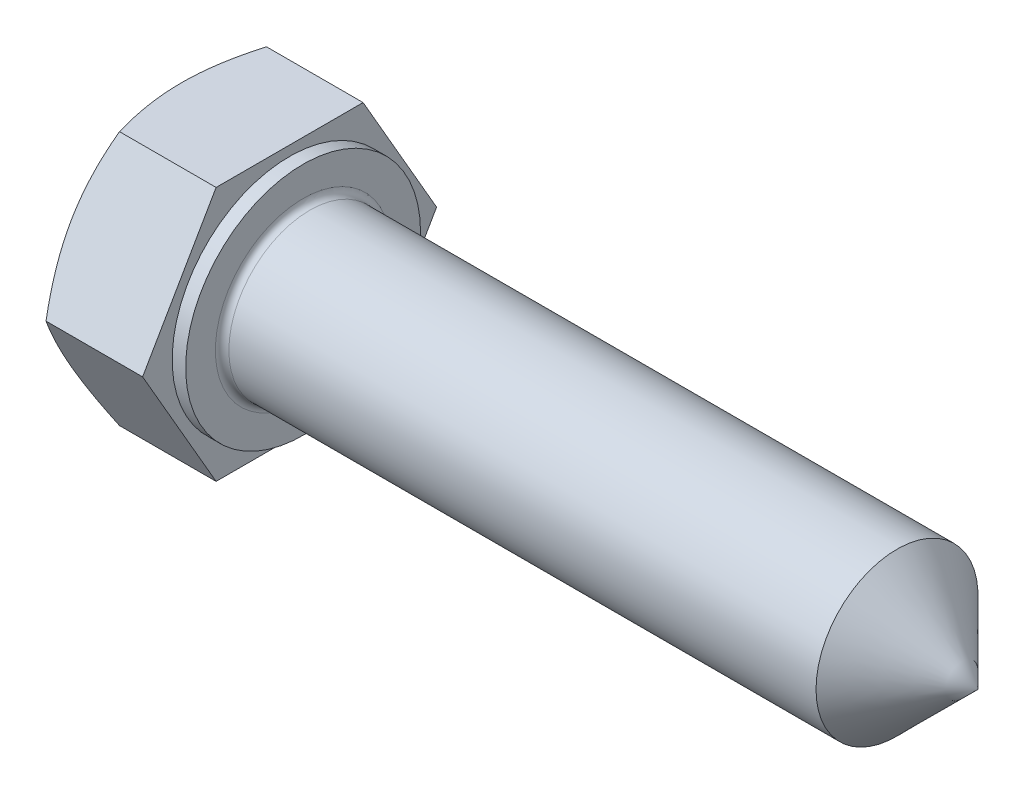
SolidWorks part; units mm, degrees
ref_plane "Front" through (0, 0, 0) normal (0, 0, 1) x (1, 0, 0)
ref_plane "Top" through (0, 0, 0) normal (0, 1, 0) x (1, 0, 0)
ref_plane "Right" through (0, 0, 0) normal (1, 0, 0) x (0, 0, -1)
sketch "Sketch3" plane through (0, 0, 0) normal (1, 0, 0) x (0, 0, -1)
  line L1 (-5.445, 0) -> (-2.7225, -4.7155)
  line L2 (-2.7225, -4.7155) -> (2.7225, -4.7155)
  line L3 (2.7225, -4.7155) -> (5.445, 0)
  line L4 (5.445, 0) -> (2.7225, 4.7155)
  line L5 (2.7225, 4.7155) -> (-2.7225, 4.7155)
  line L6 (-2.7225, 4.7155) -> (-5.445, 0)
  circle A0 centre (0, 0) radius 4.7155 construction
  dimension "e" = 10.89
extrude "BaseHead" add sketch "Sketch3" along normal blind 4
sketch "Sketch2" plane through (4, -1.7393, 0.8693) normal (1, 0, 0) x (0, 0, -1)
  circle A0 centre (0.8693, 1.7393) radius 4.35
  dimension "dw" = 8.7
extrude "Neck" add sketch "Sketch2" along normal blind 0.5
sketch "Sketch1" plane through (4.5, -1.8832, 0.2627) normal (1, 0, 0) x (0, 0, -1)
  circle A0 centre (0.2627, 1.8832) radius 3
  dimension "d" = 6
extrude "BaseBody" add sketch "Sketch1" along normal blind 25
sketch "Sketch4" plane through (6.9064, 0, -1.4614) normal (0, 1, 0) x (0, 0, -1)
  line L0 (3.9836, 2.9064) -> (3.9836, 6.9064) construction
  line L1 (3.9836, 6.9064) -> (3.9836, 6.4852)
  line L3 (3.2541, 6.9064) -> (3.9836, 6.9064)
  line L4 (-1.4614, -0.8876) -> (-1.4614, 9.2553) construction
  line L6 (3.2541, 6.9064) -> (3.9836, 6.4852)
  line L7 (3.9836, 6.9064) -> (1.2611, 6.9064) construction
  dimension "D2" = 30
revolve "Cut-Revolve1" cut sketch "Sketch4" angle 360 about L4
sketch "Sketch6" plane through (-10.5798, 0, 31.5798) normal (0, 1, 0) x (0, 0, -1)
  line L0 (31.5798, -1.5701) -> (31.5798, -40.5895) construction
  line L2 (31.5798, -43.0146) -> (52.5798, -43.0146)
  line L3 (52.5798, -43.0146) -> (52.5798, -19.0798)
  line L4 (52.5798, -19.0798) -> (31.5798, -40.0798)
  line L5 (31.5798, -40.0798) -> (31.5798, -43.0146)
  line L6 (28.5798, -40.0798) -> (34.5798, -40.0798) construction
  dimension "D1" = 45
  dimension "D2" = 21
  dimension "D3" = 2.9348
revolve "Cut-Revolve2" cut sketch "Sketch6" angle 360 about L0
fillet "Fillet1" radius 0.25 1 edges at (4.5, 0, -3)
sketch "Sketch7" plane through (0, 0, 0) normal (0, 0, 1) x (1, 0, 0)
  line L0 (6.5, 3.2) -> (7.25, 3.2)
  line L1 (7.25, 3.2) -> (7.25, 3)
  line L2 (7.25, 3) -> (6.875, 2.3505)
  line L3 (6.5, 3) -> (6.875, 2.3505)
  line L4 (6.5, 3.2) -> (6.5, 3)
  line L5 (10.7743, 0) -> (0, 0) construction
  line L6 (6.5, 3) -> (7.25, 3) construction
  line L7 (6.875, 3) -> (6.875, 2.3505) construction
  line L8 (26.5, 3) -> (4.75, 3) construction
  point P5 (6.875, 3.2)
  dimension "D1" = 0.2
  dimension "D2" = 0.75
  dimension "D3" = 23
revolve "Cut-Revolve10" [suppressed] cut sketch "Sketch7" angle 360 about L5
pattern_linear "LPattern10" [suppressed] count 15 spacing 1.5
equation "\"D2@Sketch7\" = (  \"d@Sketch1\" - \"dm@ThreadCosmetic1\" )  / 2"
equation "\"D3@Sketch7\" = \"D1@ThreadCosmetic1\" + \"d@Sketch1\" / 2"
equation "\"D3@LPattern10\" = \"D2@Sketch7\" * 2"
equation "\"D1@LPattern10\" = \"D3@Sketch7\" / \"D3@LPattern10\""
